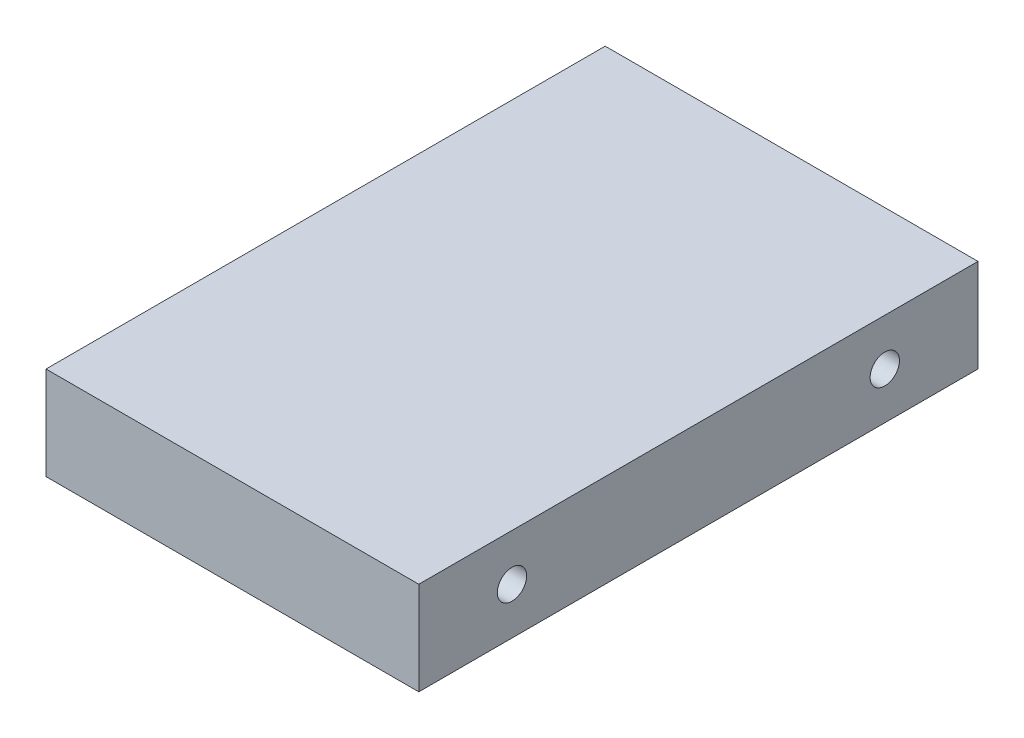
SolidWorks part; units mm, degrees
ref_plane "Front Plane" through (0, 0, 0) normal (0, 0, 1) x (1, 0, 0)
ref_plane "Top Plane" through (0, 0, 0) normal (0, 1, 0) x (1, 0, 0)
ref_plane "Right Plane" through (0, 0, 0) normal (1, 0, 0) x (0, 0, -1)
sketch "Sketch2" plane through (0, 0, 0) normal (0, 1, 0) x (1, 0, 0)
  line L1 (-65.4997, 16.1099) -> (-14.6997, 16.1099)
  line L2 (-65.4997, 16.1099) -> (-65.4997, -60.0901)
  line L3 (-65.4997, -60.0901) -> (-14.6997, -60.0901)
  line L4 (-14.6997, 16.1099) -> (-14.6997, -60.0901)
  dimension "D1" = 76.2
  dimension "D2" = 50.8
extrude "Boss-Extrude1" add sketch "Sketch2" along normal blind 12.7
sketch "Sketch3" plane through (-14.6997, 0, 0) normal (1, 0, 0) x (0, 0, -1)
  line L0 (-60.0901, 0) -> (16.1099, 0) construction
  line L1 (-60.0901, 12.7) -> (-60.0901, 0) construction
  line L2 (-60.0901, 12.7) -> (16.1099, 12.7) construction
  line L3 (16.1099, 12.7) -> (16.1099, 0) construction
  circle A0 centre (-47.3901, 6.35) radius 2
  circle A1 centre (3.4099, 6.35) radius 2
  point P6 (-60.0901, 6.35)
  dimension "D3" = 4
  dimension "D6" = 4
  dimension "D1" = 6.35
  dimension "D2" = 12.7
  dimension "D4" = 6.35
  dimension "D5" = 12.7
hole_wizard "Ø4.0 (4) Diameter Hole1" positions "3DSketch2" profile "Sketch5" hole size "Ø4.0" standard "Ansi Metric"
sketch3d "3DSketch2"
  point P0 (-14.6997, 6.35, -3.4099)
  point P3 (-14.6997, 6.35, 47.3901)
sketch "Sketch5" plane through (-14.6997, 6.35, -3.4099) normal (0, 1, 0) x (0, 0, -1)
  line L0 (0, 0) -> (0, 50.8)
  line L1 (0, 50.8) -> (2, 50.8)
  line L2 (2, 50.8) -> (2, 0)
  line L5 (2, 0) -> (0, 0)
  line L11 (0, -6.35) -> (0, 107.95) construction
  dimension "Thru Hole Dia." = 4
  dimension "Thru Hole Depth" = 50.8
